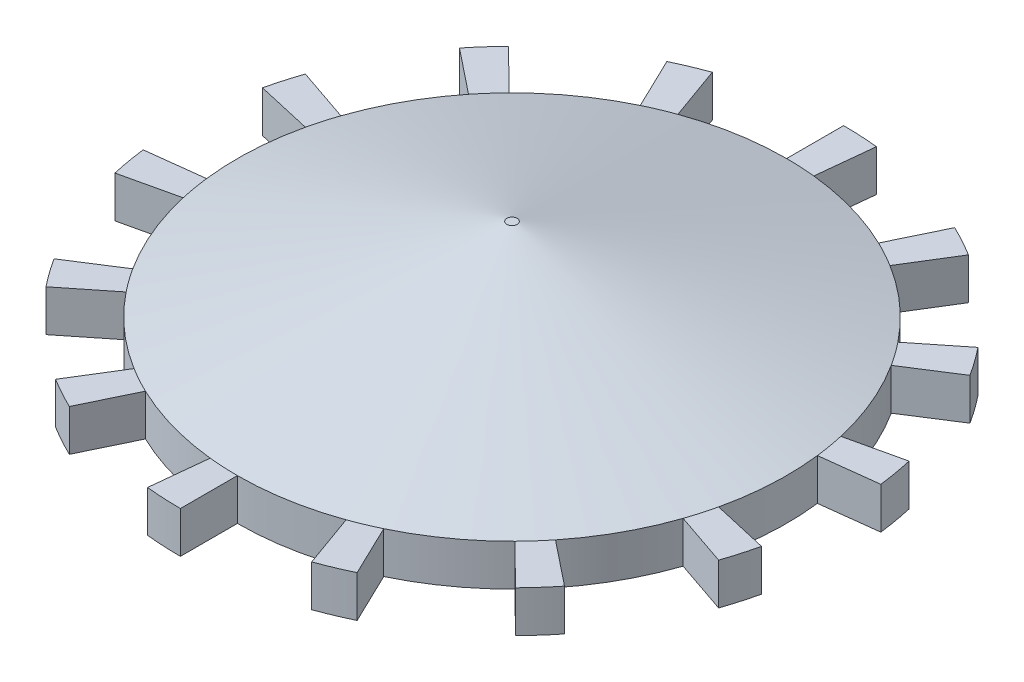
SolidWorks part; units mm, degrees
ref_plane "Front Plane" through (0, 0, 0) normal (0, 0, 1) x (1, 0, 0)
ref_plane "Top Plane" through (0, 0, 0) normal (0, 1, 0) x (1, 0, 0)
ref_plane "Right Plane" through (0, 0, 0) normal (1, 0, 0) x (0, 0, -1)
sketch "main body" plane through (0, 0, 0) normal (0, 1, 0) x (1, 0, 0)
  line L1 (-3.175, -1.6764) -> (3.175, -1.6764)
  line L2 (-3.175, -1.6764) -> (-3.175, 1.6764)
  line L3 (-3.175, 1.6764) -> (3.175, 1.6764)
  line L4 (3.175, -1.6764) -> (3.175, 1.6764)
  line L5 (-3.175, -1.6764) -> (3.175, 1.6764) construction
  line L6 (-3.175, 1.6764) -> (3.175, -1.6764) construction
  circle A0 centre (0, 0) radius 33.655
  circle A1 centre (0, 0) radius 2.794
  dimension "D1" = 3.3528
  dimension "D2" = 67.31
  dimension "D3" = 5.588
  dimension "D4" = 6.35
extrude "Boss-Extrude1" add sketch "main body" along normal blind 12.7 contours A0 A1 L3 L4 L1 L2 | A1 L3 L2 L1 | A1 L1 L4 L3 | L3 A1 | L1 A1
sketch "Sketch4" plane through (0, 0, 0) normal (0, -1, 0) x (1, 0, 0)
  line L0 (0, 20.7918) -> (0, 40.64)
  line L1 (-2.1733, 20.6779) -> (-4.248, 40.4174)
  line L2 (9.0212, 18.7327) -> (17.633, 36.6154)
  line L3 (7.0137, 19.5731) -> (13.7091, 38.2579)
  line L4 (16.2557, 12.9635) -> (31.7736, 25.3386)
  line L5 (14.8116, 14.5916) -> (28.951, 28.5211)
  line L6 (20.2705, 4.6266) -> (39.6211, 9.0433)
  line L7 (19.6758, 6.7201) -> (38.4587, 13.1352)
  line L8 (20.2705, -4.6266) -> (39.6211, -9.0433)
  line L9 (20.643, -2.4824) -> (40.3493, -4.8522)
  line L10 (16.2557, -12.9635) -> (31.7736, -25.3386)
  line L11 (17.5217, -11.1933) -> (34.2482, -21.8786)
  line L12 (9.0212, -18.7327) -> (17.633, -36.6154)
  line L13 (10.9299, -17.6871) -> (21.3638, -34.5716)
  line L14 (0, -20.7918) -> (0, -40.64)
  line L15 (2.1733, -20.6779) -> (4.248, -40.4174)
  line L16 (-9.0212, -18.7327) -> (-17.633, -36.6154)
  line L17 (-7.0137, -19.5731) -> (-13.7091, -38.2579)
  line L18 (-16.2557, -12.9635) -> (-31.7736, -25.3386)
  line L19 (-14.8116, -14.5916) -> (-28.951, -28.5211)
  line L20 (-20.2705, -4.6266) -> (-39.6211, -9.0433)
  line L21 (-19.6758, -6.7201) -> (-38.4587, -13.1352)
  line L22 (-20.2705, 4.6266) -> (-39.6211, 9.0433)
  line L23 (-20.643, 2.4824) -> (-40.3493, 4.8522)
  line L24 (-16.2557, 12.9635) -> (-31.7736, 25.3386)
  line L25 (-17.5217, 11.1933) -> (-34.2482, 21.8786)
  line L26 (-9.0212, 18.7327) -> (-17.633, 36.6154)
  line L27 (-10.9299, 17.6871) -> (-21.3638, 34.5716)
  arc A0 (0, 40.64) -> (-4.248, 40.4174) centre (0, 0) ccw
  arc A1 (0, 20.7918) -> (-2.1733, 20.6779) centre (0, 0) ccw
  arc A2 (17.633, 36.6154) -> (13.7091, 38.2579) centre (0, 0) ccw
  arc A3 (9.0212, 18.7327) -> (7.0137, 19.5731) centre (0, 0) ccw
  arc A4 (31.7736, 25.3386) -> (28.951, 28.5211) centre (0, 0) ccw
  arc A5 (16.2557, 12.9635) -> (14.8116, 14.5916) centre (0, 0) ccw
  arc A6 (39.6211, 9.0433) -> (38.4587, 13.1352) centre (0, 0) ccw
  arc A7 (20.2705, 4.6266) -> (19.6758, 6.7201) centre (0, 0) ccw
  arc A8 (39.6211, -9.0433) -> (40.3493, -4.8522) centre (0, 0) ccw
  arc A9 (20.2705, -4.6266) -> (20.643, -2.4824) centre (0, 0) ccw
  arc A10 (31.7736, -25.3386) -> (34.2482, -21.8786) centre (0, 0) ccw
  arc A11 (16.2557, -12.9635) -> (17.5217, -11.1933) centre (0, 0) ccw
  arc A12 (17.633, -36.6154) -> (21.3638, -34.5716) centre (0, 0) ccw
  arc A13 (9.0212, -18.7327) -> (10.9299, -17.6871) centre (0, 0) ccw
  arc A14 (0, -40.64) -> (4.248, -40.4174) centre (0, 0) ccw
  arc A15 (0, -20.7918) -> (2.1733, -20.6779) centre (0, 0) ccw
  arc A16 (-17.633, -36.6154) -> (-13.7091, -38.2579) centre (0, 0) ccw
  arc A17 (-9.0212, -18.7327) -> (-7.0137, -19.5731) centre (0, 0) ccw
  arc A18 (-31.7736, -25.3386) -> (-28.951, -28.5211) centre (0, 0) ccw
  arc A19 (-16.2557, -12.9635) -> (-14.8116, -14.5916) centre (0, 0) ccw
  arc A20 (-39.6211, -9.0433) -> (-38.4587, -13.1352) centre (0, 0) ccw
  arc A21 (-20.2705, -4.6266) -> (-19.6758, -6.7201) centre (0, 0) ccw
  arc A22 (-39.6211, 9.0433) -> (-40.3493, 4.8522) centre (0, 0) ccw
  arc A23 (-20.2705, 4.6266) -> (-20.643, 2.4824) centre (0, 0) ccw
  arc A24 (-31.7736, 25.3386) -> (-34.2482, 21.8786) centre (0, 0) ccw
  arc A25 (-16.2557, 12.9635) -> (-17.5217, 11.1933) centre (0, 0) ccw
  arc A26 (-17.633, 36.6154) -> (-21.3638, 34.5716) centre (0, 0) ccw
  arc A27 (-9.0212, 18.7327) -> (-10.9299, 17.6871) centre (0, 0) ccw
  point P76 (0, 0)
  dimension "D2" = 40.64
  dimension "D1" = 14
  dimension "D3" = 6
extrude "teeth" add sketch "Sketch4" against normal blind 5.08
sketch "Sketch5" plane through (0, 0, 0) normal (0, -1, 0) x (1, 0, 0)
  circle A0 centre (0, 0) radius 8.89
  circle A1 centre (0, 0) radius 25.4
  dimension "D1" = 50.8
  dimension "D2" = 17.78
sketch "Sketch6" plane through (0, 12.7, 0) normal (0, 1, 0) x (1, 0, 0)
  circle A0 centre (0, 0) radius 33.655
extrude "Boss-Extrude2" add sketch "Sketch6" along normal blind 2.54
extrude "screw clearance recess" cut sketch "Sketch5" against normal blind 5.08
chamfer "Chamfer1" distance 10.16 distance2 33.02 1 edges at (0, 15.24, 33.655)
chamfer "Chamfer2" distance 1.016 angle 45 4 edges at (2.794, 0, 0) (-2.794, 0, 0) (0, 0, 1.6764) (0, 0, -1.6764)
